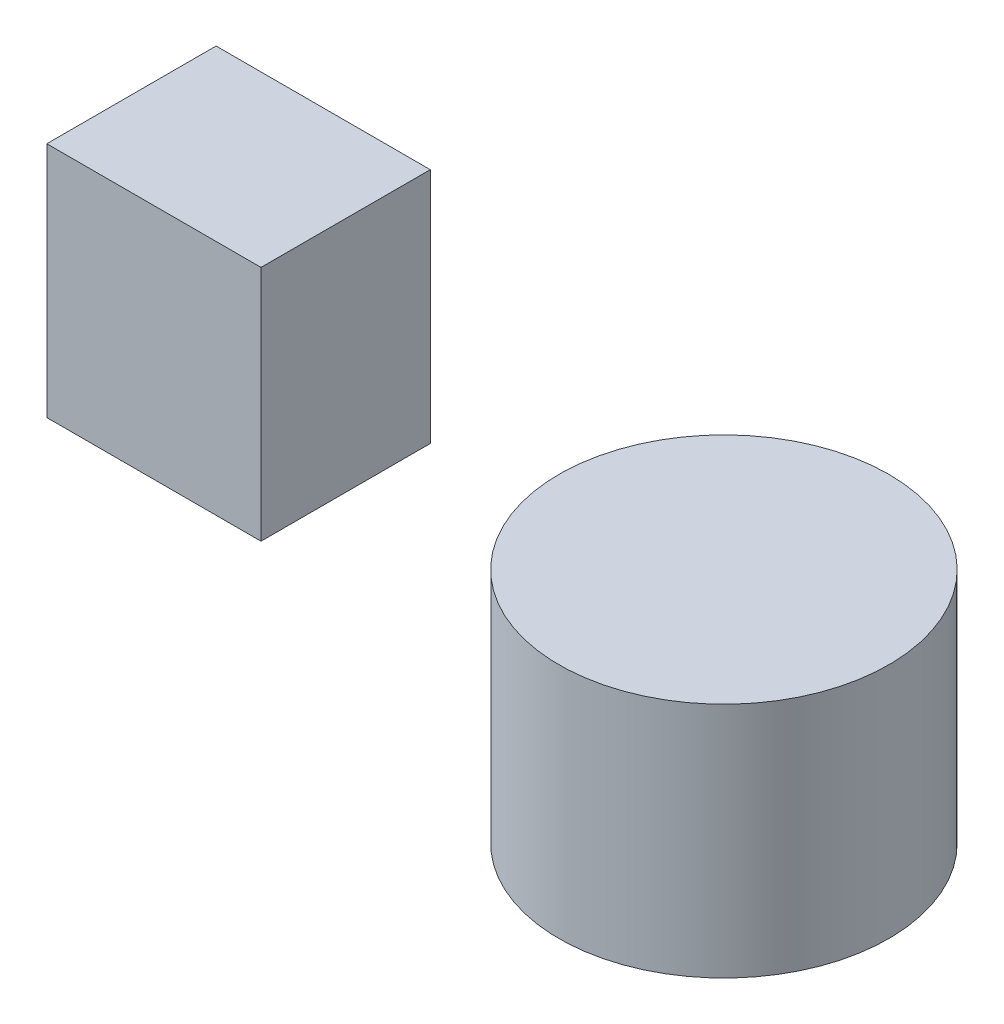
SolidWorks part; units mm, degrees
ref_plane "Front Plane" through (0, 0, 0) normal (0, 0, 1) x (1, 0, 0)
ref_plane "Top Plane" through (0, 0, 0) normal (0, 1, 0) x (1, 0, 0)
ref_plane "Right Plane" through (0, 0, 0) normal (1, 0, 0) x (0, 0, -1)
sketch "Sketch1" plane through (0, 0, 0) normal (0, 1, 0) x (1, 0, 0)
  line L1 (-155.0873, 43.7426) -> (-108.1256, 43.7426)
  line L2 (-155.0873, 43.7426) -> (-155.0873, 6.6277)
  line L3 (-155.0873, 6.6277) -> (-108.1256, 6.6277)
  line L4 (-108.1256, 43.7426) -> (-108.1256, 6.6277)
  line L5 (-155.0873, 43.7426) -> (-108.1256, 6.6277) construction
  line L6 (-155.0873, 6.6277) -> (-108.1256, 43.7426) construction
  circle A0 centre (0, 0) radius 36.1681
  point P2 (-131.6065, 25.1851)
extrude "Boss-Extrude1" add sketch "Sketch1" along normal blind 52
sketch "Sketch3" plane through (0, 52, 0) normal (0, 1, 0) x (1, 0, 0)
  spline S0 degree 3 poles (161.7875, -57.0707) (194.2327, 248.6446) (261.731, -273.4191) (329.4973, 92.5879) (401.3979, 64.4709) knots 0 0 0 0 0.582145 1 1 1 1
ref_point "Point27"
ref_point "Point28"
ref_point "Point29"
ref_point "Point30"
ref_point "Point31"
ref_point "Point32"
